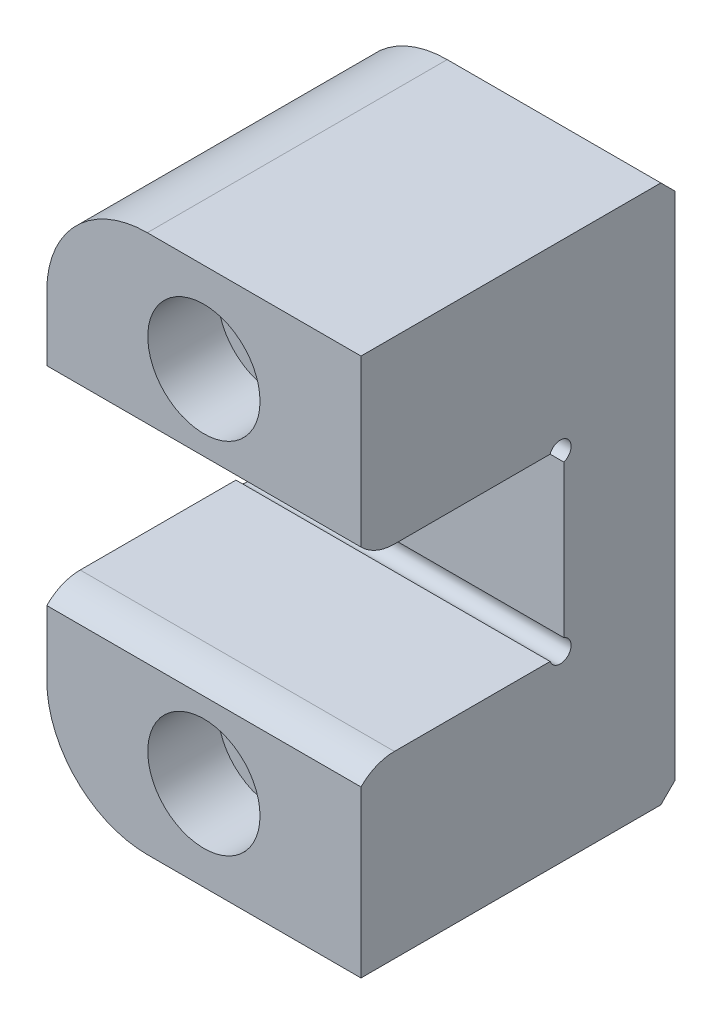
SolidWorks part; units mm, degrees
ref_plane "Front Plane" through (0, 0, 0) normal (0, 0, 1) x (1, 0, 0)
ref_plane "Top Plane" through (0, 0, 0) normal (0, 1, 0) x (1, 0, 0)
ref_plane "Right Plane" through (0, 0, 0) normal (1, 0, 0) x (0, 0, -1)
sketch "Sketch1" plane through (0, 0, 0) normal (1, 0, 0) x (0, 0, -1)
  line L0 (0, 0) -> (50000, 0) construction
  line L1 (0, 6.35) -> (14.351, 6.35)
  line L2 (0, 19.05) -> (22.225, 19.05)
  line L3 (0, 19.05) -> (0, 6.35)
  line L4 (0, -19.05) -> (22.225, -19.05)
  line L5 (22.225, 19.05) -> (22.225, -19.05)
  line L6 (14.351, 6.35) -> (14.351, -6.35)
  line L7 (14.351, -6.35) -> (0, -6.35)
  line L9 (0, 10.4775) -> (0, -10.4775) construction
  line L10 (0, -6.35) -> (0, -19.05)
  dimension "D1" = 22.225
  dimension "D2" = 38.1
  dimension "D3" = 14.351
  dimension "D4" = 12.7
extrude "Extrude1" add sketch "Sketch1" along normal mid plane 22.225
fillet "Fillet1" radius 7.112 2 edges at (-11.1125, -19.05, -11.1125) (-11.1125, 19.05, -11.1125)
sketch "Sketch2" plane through (-11.1125, 0, -22.225) normal (0, 0, 1) x (1, 0, 0)
  line L0 (0, 0) -> (50000, 0) construction
  line L1 (22.225, -19.05) -> (22.225, 19.05) construction
  line L2 (20.6375, 3.846) -> (23.8125, 5.679) construction
  line L3 (20.6375, 3.846) -> (20.6375, -3.846) construction
  line L4 (20.6375, -3.846) -> (23.8125, -5.679) construction
  line L5 (23.8125, 5.679) -> (23.8125, -5.679) construction
  line L6 (11.1125, 0) -> (11.1125, 50000) construction
  line L7 (-1.5875, 5.679) -> (-1.5875, -5.679)
  line L8 (1.5875, -3.846) -> (-1.5875, -5.679)
  line L9 (1.5875, 3.846) -> (1.5875, -3.846)
  line L10 (1.5875, 3.846) -> (-1.5875, 5.679)
  point P4 (22.225, 4.7625)
  point P10 (22.225, -4.7625)
  point P13 (0, -4.7625)
  point P14 (0, 4.7625)
  dimension "D1" = 9.525
  dimension "D2" = 1.5875
  dimension "D3" = 30
  dimension "D4" = 3.175
extrude "Cut-Extrude1" cut sketch "Sketch2" along normal through all
sketch "Sketch5" plane through (11.1125, 0, 0) normal (1, 0, 0) x (0, 0, -1)
  line L0 (0, 0) -> (50000, 0) construction
  line L1 (0, 6.35) -> (14.351, 6.35) construction
  line L2 (0, 19.05) -> (0, 6.35) construction
  line L3 (0, -6.35) -> (0, -19.05) construction
  line L4 (-3.9878, -4.171) -> (2.3622, -4.171)
  line L5 (-3.9878, -4.171) -> (-3.9878, -7.346)
  line L6 (-3.9878, -7.346) -> (0, -7.346)
  line L7 (2.3622, -4.171) -> (2.3622, -6.35)
  line L8 (14.351, -6.35) -> (0, -6.35) construction
  line L9 (2.3622, 4.171) -> (2.3622, 6.35)
  line L10 (-3.9878, 7.346) -> (0, 7.346)
  line L11 (-3.9878, 4.171) -> (-3.9878, 7.346)
  line L12 (-3.9878, 4.171) -> (2.3622, 4.171)
  arc A0 (0.5438, -6.6159) -> (2.3622, -6.35) centre (2.3622, -12.7) cw construction
  arc A1 (0, -7.346) -> (0.5438, -6.6159) centre (0.762, -7.346) cw construction
  arc A2 (0, 7.346) -> (0.5438, 6.6159) centre (0.762, 7.346) ccw construction
  arc A3 (0.5438, 6.6159) -> (2.3622, 6.35) centre (2.3622, 12.7) ccw construction
  arc A4 (0, 7.346) -> (2.3622, 6.35) centre (2.3622, 9.6492) ccw
  arc A5 (0, -7.346) -> (2.3622, -6.35) centre (2.3622, -9.6492) cw
  dimension "D1" = 0.762
  dimension "D2" = 6.35
  dimension "D3" = 3.175
  dimension "D4" = 6.35
  dimension "D5" = 2.3622
extrude "Cut-Extrude2" cut sketch "Sketch5" against normal through all
sketch "Sketch6" plane through (11.1125, 0, 0) normal (1, 0, 0) x (0, 0, -1)
  line L0 (0, 0) -> (50000, 0) construction
  line L3 (14.351, 6.35) -> (14.351, -6.35) construction
  line L4 (2.3622, 6.35) -> (14.351, 6.35) construction
  circle A0 centre (14.097, 6.096) radius 0.762
  circle A1 centre (14.097, -6.096) radius 0.762
  dimension "D2" = 0.508
  dimension "D3" = 0.762
  dimension "D1" = 0.508
extrude "Cut-Extrude3" cut sketch "Sketch6" against normal through all
hole_wizard "CBORE for #8 Socket Head Cap Screw1" positions "Sketch4" profile "Sketch3" counterbore size "#8" standard "Ansi Inch"
sketch "Sketch4" plane through (0, 0, 0) normal (0, 0, 1) x (1, 0, 0)
  line L0 (0, 0) -> (0, 50000) construction
  line L1 (0, 0) -> (50000, 0) construction
  point P0 (0, 12.7)
  point P12 (0, -12.7)
  dimension "D1" = 25.4
sketch "Sketch3" plane through (0, 12.7, 0) normal (1, 0, 0) x (0, -1, 0)
  line L0 (0, 0) -> (0, 22.225)
  line L1 (0, 22.225) -> (2.4574, 22.225)
  line L3 (2.4574, 22.225) -> (2.4575, 4.9606)
  line L4 (2.4575, 4.9606) -> (3.9687, 4.9606)
  line L5 (3.9687, 4.9606) -> (3.9687, 0)
  line L7 (3.9687, 0) -> (0, 0)
  line L11 (0, -6.35) -> (0, 107.95) construction
  dimension "Thru Hole Dia." = 4.9149
  dimension "Thru Hole Depth" = 22.225
  dimension "C'Bore Dia." = 7.9375
  dimension "C'Bore Depth" = 4.9606
chamfer "Chamfer3" distance 3.81 angle 15 1 edges at (-9.525, 0, -14.351)
chamfer "Chamfer1" distance 1.016 angle 45 6 edges at (-11.1125, -8.3502, -22.225) (-9.0294, -16.9669, -22.225) (3.556, -19.05, -22.225) (3.556, 19.05, -22.225) (-11.1125, 8.3503, -22.225) (-9.0294, 16.9669, -22.225)
